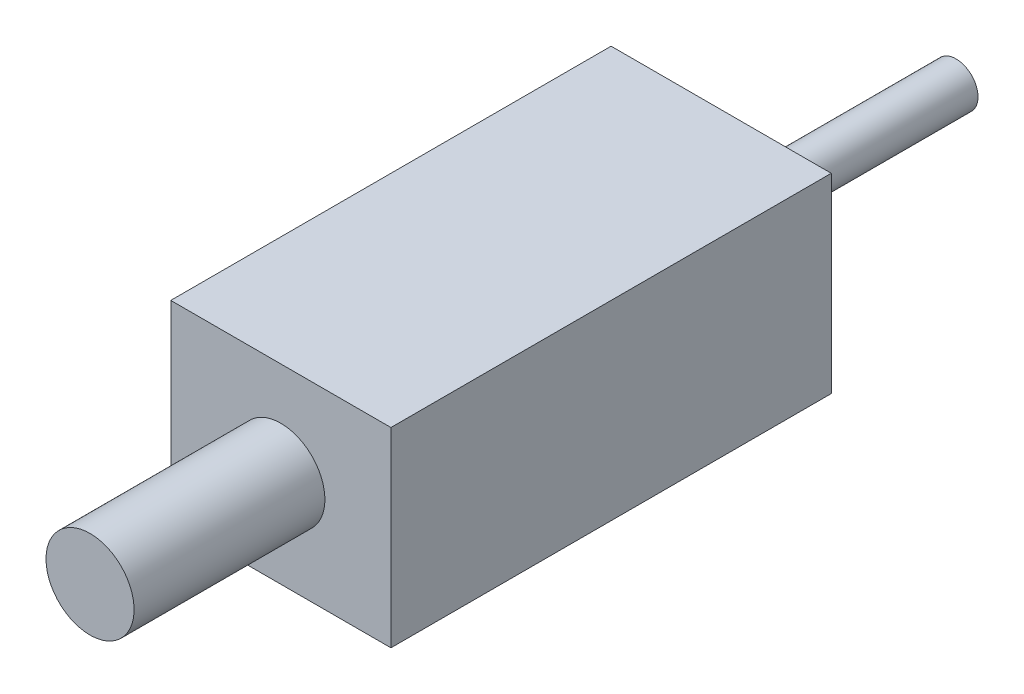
SolidWorks part; units mm, degrees
ref_plane "Front Plane" through (0, 0, 0) normal (0, 0, 1) x (1, 0, 0)
ref_plane "Top Plane" through (0, 0, 0) normal (0, 1, 0) x (1, 0, 0)
ref_plane "Right Plane" through (0, 0, 0) normal (1, 0, 0) x (0, 0, -1)
sketch "Sketch1" plane through (0, 0, 0) normal (0, 0, 1) x (1, 0, 0)
  line L1 (-7.5, 6.5) -> (7.5, 6.5)
  line L2 (-7.5, 6.5) -> (-7.5, -6.5)
  line L3 (-7.5, -6.5) -> (7.5, -6.5)
  line L4 (7.5, 6.5) -> (7.5, -6.5)
  line L5 (-7.5, 6.5) -> (7.5, -6.5) construction
  line L6 (-7.5, -6.5) -> (7.5, 6.5) construction
  point P0 (0, 0)
  dimension "D1" = 13
  dimension "D2" = 15
extrude "Boss-Extrude1" add sketch "Sketch1" along normal blind 30
sketch "Sketch2" plane through (0, 0, 0) normal (0, 0, -1) x (-1, 0, 0)
  circle A0 centre (0, 0) radius 1.5
  dimension "D1" = 3
extrude "Boss-Extrude2" add sketch "Sketch2" along normal blind 16 contours A0
sketch "Sketch3" plane through (0, 0, 30) normal (0, 0, 1) x (1, 0, 0)
  circle A0 centre (0, 0) radius 3
  dimension "D1" = 6
extrude "Boss-Extrude3" add sketch "Sketch3" along normal blind 13
ref_plane "Plane4" through (0, 6.5, 0) normal (0, 1, 0) x (1, 0, 0)
